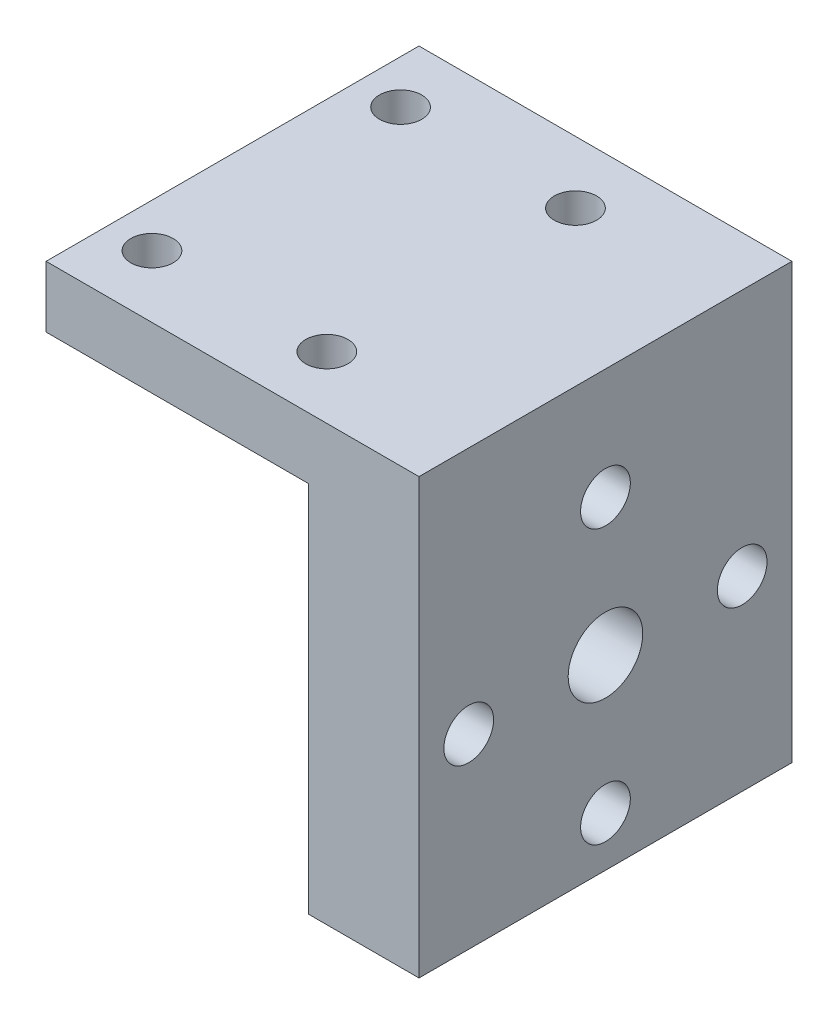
SolidWorks part; units mm, degrees
ref_plane "Front Plane" through (0, 0, 0) normal (0, 0, 1) x (1, 0, 0)
ref_plane "Top Plane" through (0, 0, 0) normal (0, 1, 0) x (1, 0, 0)
ref_plane "Right Plane" through (0, 0, 0) normal (1, 0, 0) x (0, 0, -1)
sketch "Sketch1" plane through (0, 0, 0) normal (0, 0, 1) x (1, 0, 0)
  line L1 (0, 0) -> (8.8969, 0)
  line L2 (0, 0) -> (0, 30)
  line L4 (8.8969, 0) -> (8.8969, 30)
  line L5 (0, 30) -> (-21.1031, 30)
  line L6 (8.8969, 30) -> (8.8969, 34.932)
  line L7 (8.8969, 34.932) -> (-21.1031, 34.932)
  line L8 (-21.1031, 30) -> (-21.1031, 34.932)
extrude "Boss-Extrude1" add sketch "Sketch1" along normal blind 30
sketch "Sketch2" plane through (0, 0, 0) normal (-1, 0, 0) x (0, 0, 1)
  line L0 (0, 0) -> (30, 30) construction
  line L1 (0, 30) -> (30, 0) construction
  circle A0 centre (15, 15) radius 8.95
  dimension "D1" = 17.9
extrude "Cut-Extrude1" cut sketch "Sketch2" against normal blind 2
sketch "Sketch4" plane through (0, 0, 0) normal (-1, 0, 0) x (0, 0, 1)
  line L0 (0, 30) -> (30, 0) construction
  line L1 (30, 30) -> (0, 0) construction
  line L2 (15, 0) -> (15, 30) construction
  line L3 (30, 0) -> (0, 0) construction
  line L4 (30, 30) -> (0, 30) construction
  line L5 (0, 15) -> (30, 15) construction
  line L6 (0, 30) -> (0, 0) construction
  line L7 (30, 30) -> (30, 0) construction
  circle A1 centre (15, 15) radius 3
  circle A2 centre (15, 15) radius 11
  circle A3 centre (15, 26) radius 2
  circle A4 centre (26, 15) radius 2
  circle A5 centre (15, 4) radius 2
  circle A6 centre (4, 15) radius 2
  dimension "D2" = 6
  dimension "D3" = 22
  dimension "D4" = 4
extrude "Cut-Extrude8" cut sketch "Sketch4" against normal through all contours A2 A6 | A2 A6 | A2 A3 | A2 A3 | A1 | A2 A4 | A2 A4 | A2 A5 | A2 A5
sketch "Sketch5" plane through (0, 30, 0) normal (0, -1, 0) x (1, 0, 0)
  line L0 (-10.5516, 0) -> (-10.5516, 30) construction
  line L1 (-21.1031, 0) -> (0, 0) construction
  line L2 (-21.1031, 30) -> (0, 30) construction
  line L3 (-21.1031, 15) -> (0, 15) construction
  line L4 (-21.1031, 30) -> (-21.1031, 0) construction
  line L5 (0, 30) -> (0, 0) construction
  line L6 (-21.1031, 30) -> (0, 0) construction
  line L7 (0, 30) -> (-21.1031, 0) construction
  circle A0 centre (-17.5859, 25) radius 1.7
  circle A1 centre (-3.5172, 25) radius 1.7
  circle A2 centre (-3.5172, 5) radius 1.7
  circle A3 centre (-17.5859, 5) radius 1.7
extrude "Cut-Extrude9" cut sketch "Sketch5" against normal through all
equation "\"b\" = 30"
equation "\"l\" = 30"
equation "\"E\"= 6901.16"
equation "\"Sy\"= 55.5"
equation "\"SF\"= 3"
equation "\"P\"= 300"
equation "\"delta\"= 0.30"
equation "\"shaft\"= 18"
equation "\"h_1_Deflection\"= ( ( 3 * \"P\" * \"shaft\" * ( \"l\" ^ 2 ) * \"SF\" ) / ( \"E\" * \"b\" * \"delta\" ) ) ^ ( 1 / 3 )"
equation "\"h_2_Stress\"= ( ( 3 * \"P\" * \"l\" * \"SF\" ) / ( 2 * \"b\" * \"Sy\" ) ) ^ ( 1 / 2 )"
equation "\"D1@Sketch1\"=\"l\""
equation "\"D2@Sketch1\"=\"h_2_Stress\""
equation "\"D3@Sketch1\"=\"h_1_Deflection\""
equation "\"D4@Sketch1\"=\"l\""
equation "\"D1@Boss-Extrude1\"=\"b\""
equation "\"D1@Sketch5\"=\"b\"/6"
